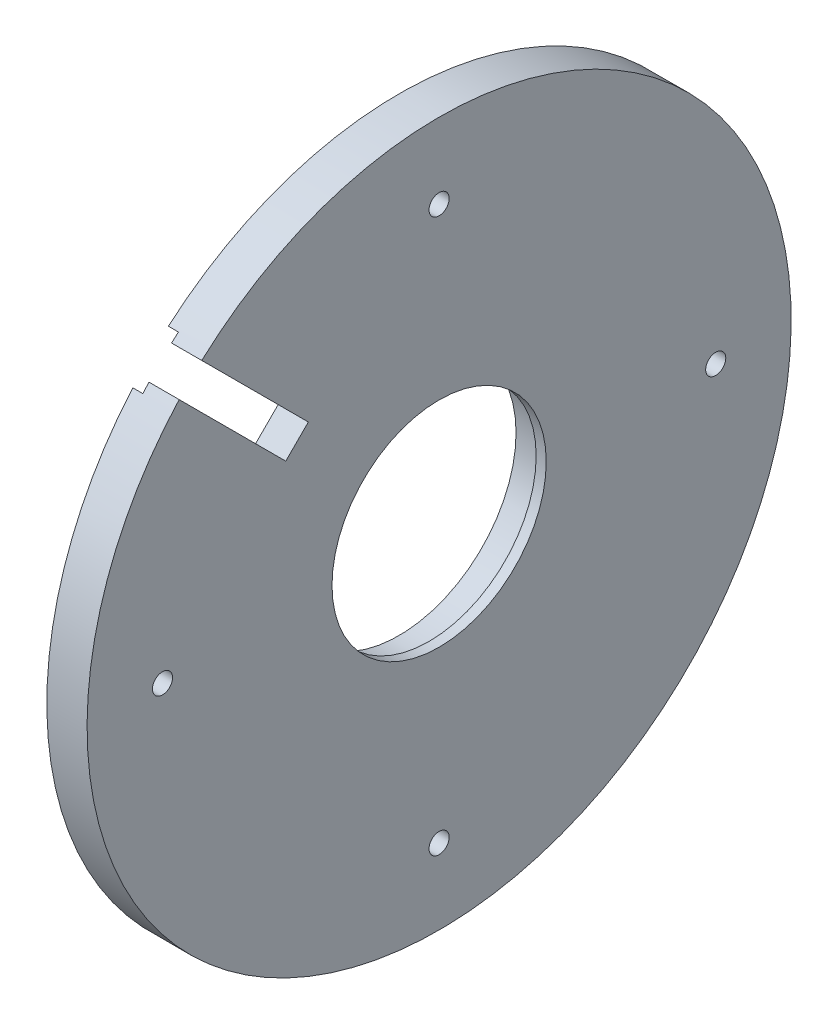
SolidWorks part; units mm, degrees
ref_plane "Front Plane" through (0, 0, 0) normal (0, 0, 1) x (1, 0, 0)
ref_plane "Top Plane" through (0, 0, 0) normal (0, 1, 0) x (1, 0, 0)
ref_plane "Right Plane" through (0, 0, 0) normal (1, 0, 0) x (0, 0, -1)
sketch "Sketch1" plane through (0, 0, 0) normal (1, 0, 0) x (0, -0.1678, -0.9858)
  circle A0 centre (-28.5429, 18.9571) radius 11.65
  circle A1 centre (-28.5429, 18.9571) radius 35
  dimension "D1" = 70
extrude "Boss-Extrude1" add sketch "Sketch1" along normal blind 4
sketch "Sketch2" plane through (0, 0, 0) normal (-1, 0, 0) x (0, 0, 1)
  line L6 (38.3756, 38.3083) -> (48.9998, 48.9326)
  line L7 (50.4141, 47.5183) -> (54.0073, 51.1116)
  line L11 (54.0073, 51.1116) -> (51.312, 52.9305)
  line L12 (51.312, 52.9305) -> (48.9998, 48.9326)
  line L13 (39.7898, 36.8941) -> (50.4141, 47.5183)
  arc A2 (39.7898, 36.8941) -> (38.3756, 38.3083) centre (24.9582, 23.4767) ccw
extrude "Cut-Extrude1" cut sketch "Sketch2" against normal blind 10
sketch "Sketch6" plane through (4, 0, 0) normal (1, 0, 0) x (0, 0, -1)
  line L0 (-24.9582, 23.4767) -> (10.0418, 23.4767) construction
  arc A0 (-50.404, 47.5082) -> (-48.9897, 48.9225) centre (-24.9582, 23.4767) ccw construction
  circle A1 centre (-24.9582, -4.0233) radius 1
  circle A2 centre (2.5418, 23.4767) radius 1
  circle A3 centre (-52.4582, 23.4767) radius 1
  circle A4 centre (-24.9582, 50.9767) radius 1
  dimension "D1" = 4
extrude "Cut-Extrude4" cut sketch "Sketch6" against normal blind 10
sketch "Sketch7" plane through (4, 0, 0) normal (-1, 0, 0) x (0, 0, 1)
  circle A1 centre (24.9582, 23.4767) radius 11.65
  circle A2 centre (24.9582, 23.4767) radius 10.65
extrude "Boss-Extrude3" add sketch "Sketch7" along normal blind 1
sketch "Sketch8" plane through (3, 0, 0) normal (-1, 0, 0) x (0, 0, 1)
  circle A0 centre (24.9582, 23.4767) radius 11.65
  circle A1 centre (24.9582, 23.4767) radius 11.15
  dimension "D1" = 0.5
extrude "Cut-Extrude5" cut sketch "Sketch8" against normal blind 0.25
fillet "Fillet1" radius 0.1 1 edges at (3.25, 23.4767, 36.1082)
sketch "Sketch9" plane through (0, 0, 0) normal (-1, 0, 0) x (0, 0, 1)
  line L0 (48.9897, 48.9225) -> (50.404, 47.5082)
  line L1 (50.404, 47.5082) -> (40.4029, 37.5072)
  line L3 (38.9887, 38.9215) -> (48.9897, 48.9225)
  line L4 (36.2542, 38.3083) -> (48.9897, 51.0438)
  line L5 (48.9897, 51.0438) -> (52.5253, 47.5082)
  line L6 (52.5253, 47.5082) -> (39.7898, 34.7727)
  line L7 (36.2542, 38.3083) -> (35.5471, 37.6012)
  line L8 (39.7898, 34.7727) -> (36.2542, 38.3083) construction
  line L9 (35.5471, 37.6012) -> (39.0827, 34.0656)
  line L10 (39.7898, 34.7727) -> (39.0827, 34.0656)
  line L11 (38.9887, 38.9215) -> (40.4029, 37.5072)
  line L12 (38.3756, 38.3083) -> (48.9897, 48.9225) construction
  line L13 (39.7898, 36.8941) -> (38.3756, 38.3083) construction
  line L14 (50.404, 47.5082) -> (39.7898, 36.8941) construction
  dimension "D2" = 1
  dimension "D1" = 1.5
extrude "Cut-Extrude6" cut sketch "Sketch9" against normal blind 1
extrude "Cut-Extrude12" cut sketch "Sketch15" against normal blind 6
sketch "Sketch15" plane through (4, 2.2652, 47.8257) normal (1, 0, 0) x (0, 0, -1)
  line L2 (7.62, 34.2129) -> (9.8656, 36.4585)
  line L3 (9.8479, 36.4761) -> (-10.674, 56.998)
  line L4 (9.8479, 36.4761) -> (9.8656, 36.4585)
  line L5 (7.6028, 34.2311) -> (-12.919, 54.753)
  line L6 (-10.674, 56.998) -> (-12.919, 54.753)
  line L8 (7.62, 34.2129) -> (7.6028, 34.2311)
